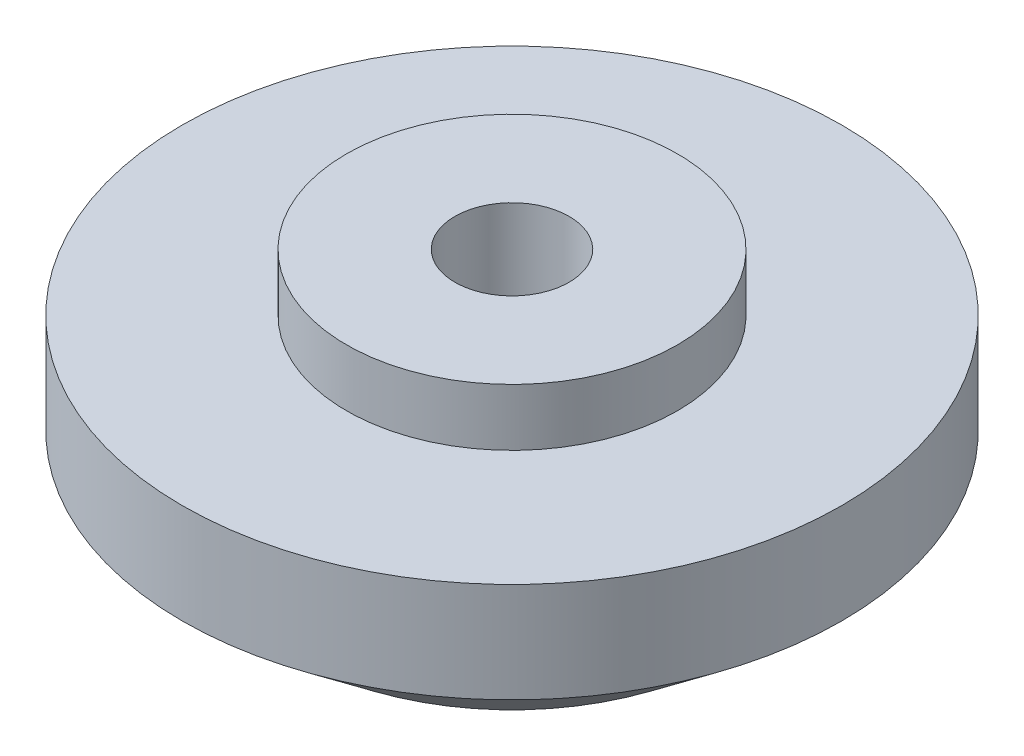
SolidWorks part; units mm, degrees
ref_plane "Plan1" through (0, 0, 0) normal (0, 0, 1) x (1, 0, 0)
ref_plane "Plan2" through (0, 0, 0) normal (0, 1, 0) x (1, 0, 0)
ref_plane "Plan3" through (0, 0, 0) normal (1, 0, 0) x (0, 0, -1)
sketch "Esquisse1" plane through (0, 0, 0) normal (0, 0, 1) x (1, 0, 0)
  line L0 (-98.5, 70) -> (-90.91, 70)
  line L1 (-90.91, 70) -> (-90.91, 53)
  line L2 (-90.91, 53) -> (-102.374, 53)
  line L3 (-102.374, 53) -> (-110, 59)
  line L4 (-110, 59) -> (-110, 66)
  line L5 (-110, 66) -> (-98.5, 66)
  line L6 (-98.5, 66) -> (-98.5, 70)
  line L7 (-86.91, 100) -> (-86.91, -40) construction
  dimension "D1" = 4
  dimension "D2" = 7.59
  dimension "D3" = 11.5
  dimension "D4" = 17
  dimension "D5" = 4
  dimension "D6" = 7
revolve "Base-Révolution" add sketch "Esquisse1" angle 360 about L7
